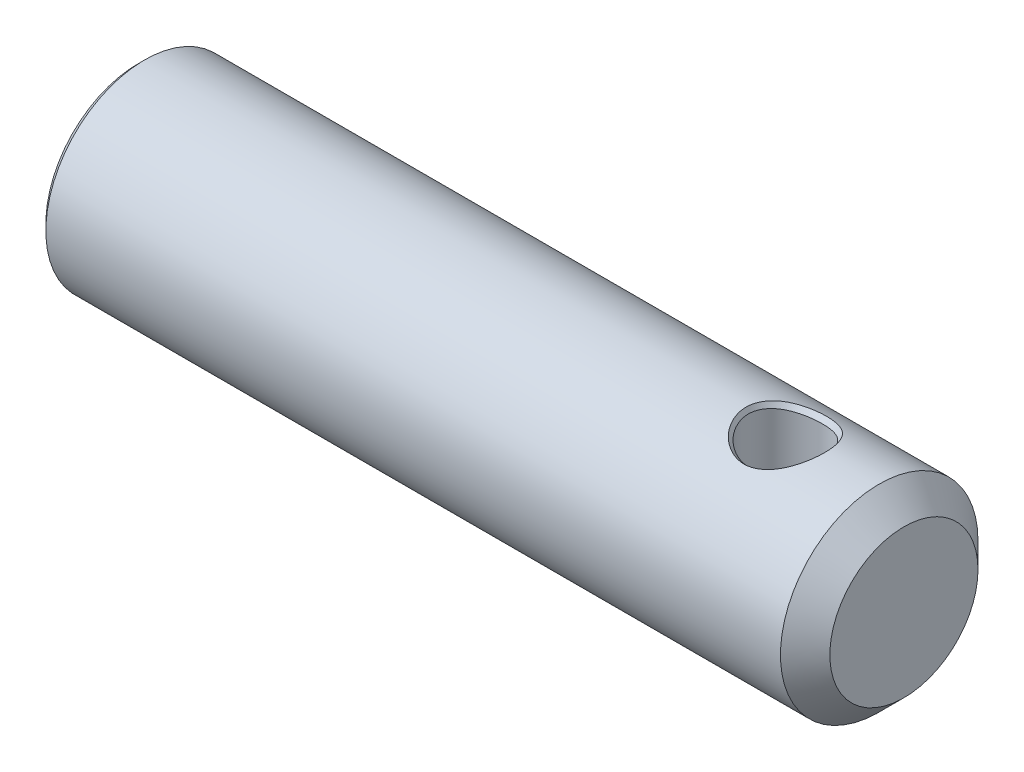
SolidWorks part; units mm, degrees
ref_plane "Спереди" through (0, 0, 0) normal (0, 0, 1) x (1, 0, 0)
ref_plane "Сверху" through (0, 0, 0) normal (0, 1, 0) x (1, 0, 0)
ref_plane "Справа" through (0, 0, 0) normal (1, 0, 0) x (0, 0, -1)
sketch "Эскиз1" plane through (0, 0, 0) normal (1, 0, 0) x (0, 0, -1)
  circle A0 centre (0, 0) radius 4
  dimension "D1" = 8
extrude "Бобышка-Вытянуть1" add sketch "Эскиз1" along normal blind 31
chamfer "Фаска1" distance 1 angle 45 1 edges at (31, 0, -4)
sketch "Эскиз2" plane through (0, 0, 0) normal (0, 1, 0) x (1, 0, 0)
  line L0 (31, -3) -> (31, 3) construction
  circle A0 centre (26.2, 0) radius 1.5
  dimension "D1" = 3
  dimension "D2" = 4.8
extrude "Вырез-Вытянуть1" cut sketch "Эскиз2" against normal mid plane 11
chamfer "Фаска2" distance 0.25 angle 45 3 edges at (25.9654, -3.7155, -1.4815) (26.4346, 3.7155, -1.4815) (0, 0, -4)
